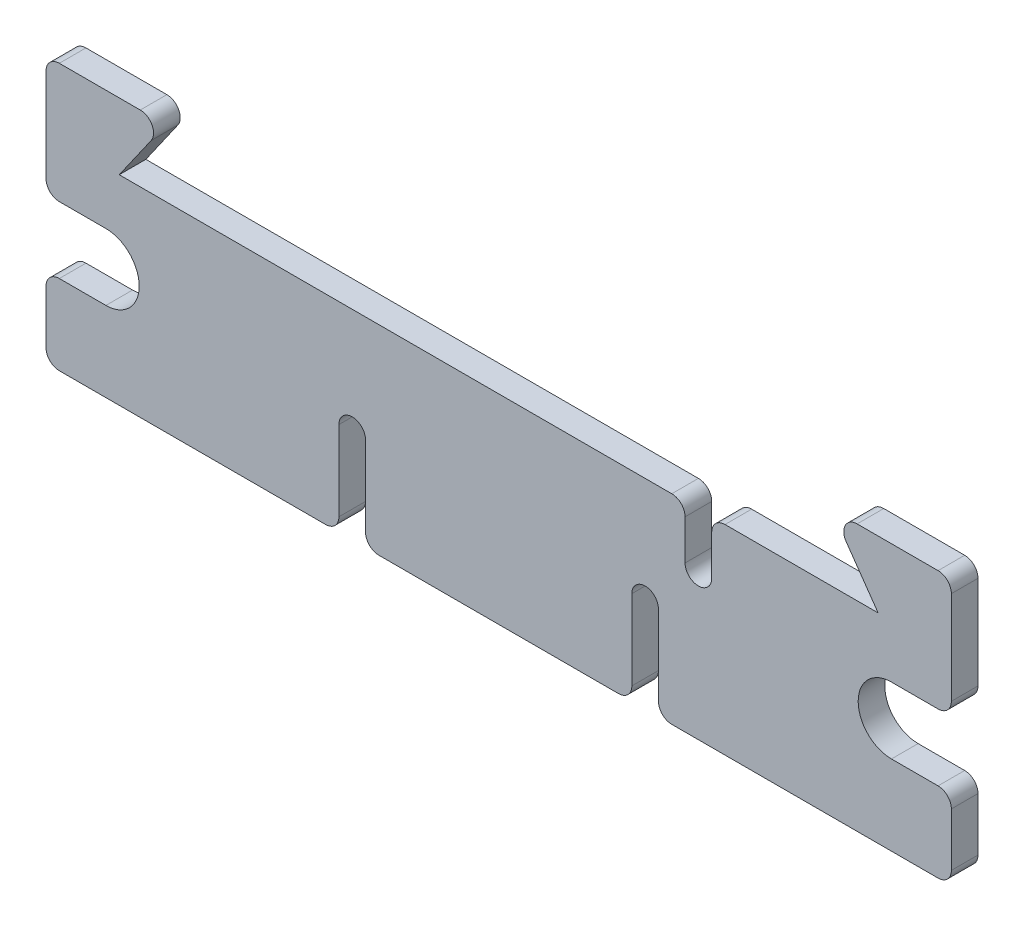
SolidWorks part; units mm, degrees
ref_plane "Plano frontal" through (0, 0, 0) normal (0, 0, 1) x (1, 0, 0)
ref_plane "Plano superior" through (0, 0, 0) normal (0, 1, 0) x (1, 0, 0)
ref_plane "Plano direito" through (0, 0, 0) normal (1, 0, 0) x (0, 0, -1)
sketch "Esboço1" plane through (0, 0, 0) normal (0, 0, 1) x (1, 0, 0)
  line L0 (-28.5, 0) -> (13, 0)
  line L1 (28.5, 0) -> (26.1014, 3.4265)
  line L2 (26.9207, 5) -> (33, 5)
  line L3 (34, 4) -> (34, -3)
  line L4 (33, -4) -> (29.5, -4)
  line L5 (29.5, -9) -> (33, -9)
  line L6 (34, -10) -> (34, -14)
  line L7 (33, -15) -> (13, -15)
  line L8 (0, 0) -> (0, -15) construction
  line L9 (11, -15) -> (11, -8) construction
  line L10 (10, -14) -> (10, -8)
  line L11 (12, -14) -> (12, -8)
  line L12 (9, -15) -> (-9, -15)
  line L13 (-10, -14) -> (-10, -8)
  line L14 (-12, -14) -> (-12, -8)
  line L15 (-33, -15) -> (-13, -15)
  line L16 (-34, -10) -> (-34, -14)
  line L17 (-29.5, -9) -> (-33, -9)
  line L18 (-33, -4) -> (-29.5, -4)
  line L19 (-34, 4) -> (-34, -3)
  line L20 (-26.9207, 5) -> (-33, 5)
  line L21 (-28.5, 0) -> (-26.1014, 3.4265)
  line L22 (15, 0) -> (15, -4) construction
  line L23 (16, -1) -> (16, -4)
  line L24 (14, -1) -> (14, -4)
  line L25 (17, 0) -> (28.5, 0)
  arc A0 (29.5, -4) -> (29.5, -9) centre (29.5, -6.5) ccw
  arc A1 (10, -14) -> (9, -15) centre (9, -14) cw
  arc A2 (12, -8) -> (10, -8) centre (11, -8) ccw
  arc A3 (12, -14) -> (13, -15) centre (13, -14) ccw
  arc A4 (34, -14) -> (33, -15) centre (33, -14) cw
  arc A5 (33, -9) -> (34, -10) centre (33, -10) cw
  arc A6 (34, -3) -> (33, -4) centre (33, -3) cw
  arc A7 (33, 5) -> (34, 4) centre (33, 4) cw
  arc A8 (26.1014, 3.4265) -> (26.9207, 5) centre (26.9207, 4) cw
  arc A9 (-10, -14) -> (-9, -15) centre (-9, -14) ccw
  arc A10 (-26.1014, 3.4265) -> (-26.9207, 5) centre (-26.9207, 4) ccw
  arc A11 (-33, 5) -> (-34, 4) centre (-33, 4) ccw
  arc A12 (-34, -3) -> (-33, -4) centre (-33, -3) ccw
  arc A13 (-33, -9) -> (-34, -10) centre (-33, -10) ccw
  arc A14 (-34, -14) -> (-33, -15) centre (-33, -14) ccw
  arc A15 (-12, -14) -> (-13, -15) centre (-13, -14) cw
  arc A16 (-12, -8) -> (-10, -8) centre (-11, -8) cw
  arc A17 (-29.5, -4) -> (-29.5, -9) centre (-29.5, -6.5) cw
  arc A18 (16, -1) -> (17, 0) centre (17, -1) cw
  arc A19 (14, -4) -> (16, -4) centre (15, -4) ccw
  arc A20 (14, -1) -> (13, 0) centre (13, -1) ccw
  point P14 (12, -12)
  point P25 (34, -15)
  point P28 (34, -9)
  point P31 (34, -4)
  point P36 (25, 5)
  point P65 (-25, 5)
  point P66 (-34, -4)
  point P67 (-34, -9)
  point P68 (-34, -15)
  point P71 (15, -2)
  dimension "D12" = 1
  dimension "D16" = 1
  dimension "D1" = 34
  dimension "D2" = 5
  dimension "D3" = 25
  dimension "D4" = 28.5
  dimension "D5" = 9
  dimension "D6" = 5
  dimension "D7" = 2
  dimension "D8" = 20
  dimension "D9" = 7
  dimension "D10" = 10
  dimension "D11" = 8
  dimension "D13" = 2
  dimension "D14" = 5
  dimension "D15" = 18
extrude "Ressalto-extrusão1" add sketch "Esboço1" along normal blind 2
